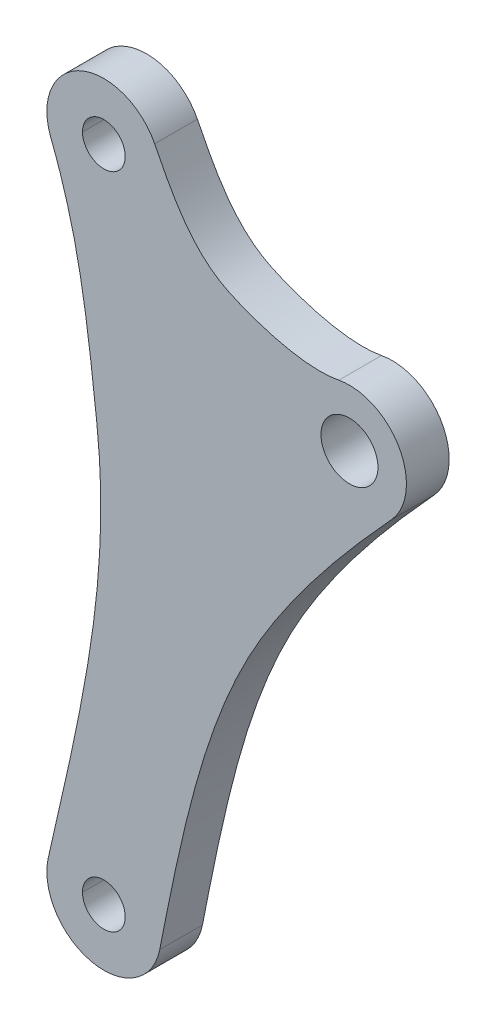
SolidWorks part; units mm, degrees
ref_plane "Front Plane" through (0, 0, 0) normal (0, 0, 1) x (1, 0, 0)
ref_plane "Top Plane" through (0, 0, 0) normal (0, 1, 0) x (1, 0, 0)
ref_plane "Right Plane" through (0, 0, 0) normal (1, 0, 0) x (0, 0, -1)
imported_body "Imported1"
sketch "Sketch1" plane through (0, 0, 3) normal (0, 0, 1) x (1, 0, 0)
  circle A0 centre (98.293, 65.3775) radius 2
extrude "Cut-Extrude1" cut sketch "Sketch1" against normal blind 3
